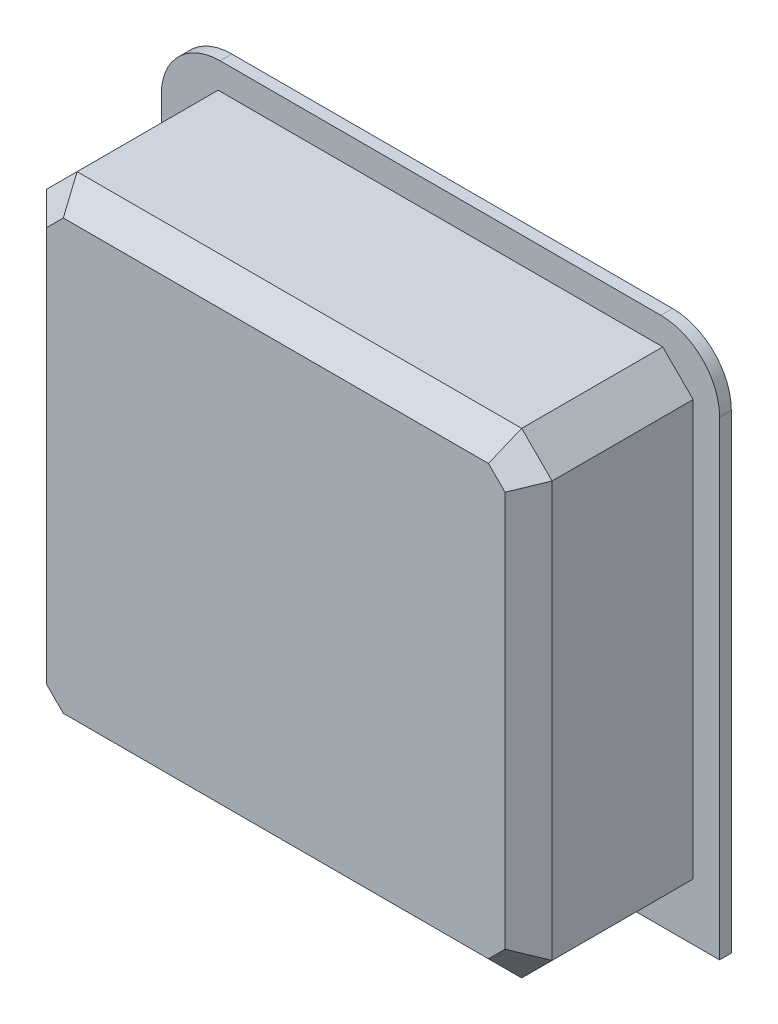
SolidWorks part; units mm, degrees
ref_plane "Front Plane" through (0, 0, 0) normal (0, 0, 1) x (1, 0, 0)
ref_plane "Top Plane" through (0, 0, 0) normal (0, 1, 0) x (1, 0, 0)
ref_plane "Right Plane" through (0, 0, 0) normal (1, 0, 0) x (0, 0, -1)
sketch "Sketch2" plane through (0, 0, 0) normal (0, 0, 1) x (1, 0, 0)
  line L0 (-37, 38.5) -> (37, 38.5)
  line L1 (47.5, -45) -> (-47.5, -45)
  line L2 (47.5, -45) -> (47.5, 45)
  line L3 (47.5, 45) -> (-47.5, 45)
  line L4 (-47.5, -45) -> (-47.5, 45)
  line L5 (47.5, -45) -> (-47.5, 45) construction
  line L6 (47.5, 45) -> (-47.5, -45) construction
  line L7 (41, 34.5) -> (41, -34.5)
  line L8 (37, -38.5) -> (-37, -38.5)
  line L9 (-41, -34.5) -> (-41, 34.5)
  line L10 (0, 38.5) -> (0, 0) construction
  line L11 (0, 0) -> (41, 0) construction
  line L12 (0, 0) -> (-41, 0) construction
  line L13 (0, 0) -> (0, -38.5) construction
  line L14 (37, 38.5) -> (41, 34.5)
  line L15 (41, -34.5) -> (37, -38.5)
  line L16 (-41, -34.5) -> (-37, -38.5)
  line L17 (-41, 34.5) -> (-37, 38.5)
  point P0 (0, 0)
  point P5 (0, 0)
  dimension "D1" = 90
  dimension "D2" = 74
  dimension "D3" = 77
  dimension "D4" = 95
  dimension "D5" = 69
  dimension "D6" = 82
extrude "Boss-Extrude1" add sketch "Sketch2" along normal blind 30
sketch "Sketch6" plane through (0, 0, 0) normal (0, 0, -1) x (-1, 0, 0)
  line L0 (-43, 35.3284) -> (-37.8284, 40.5)
  line L1 (-37, 38.5) -> (37, 38.5) construction
  line L2 (-47.5, 45) -> (47.5, 45)
  line L3 (-47.5, 45) -> (-47.5, -45)
  line L4 (-47.5, -45) -> (47.5, -45)
  line L5 (47.5, 45) -> (47.5, -45)
  line L7 (-41, 34.5) -> (-37, 38.5) construction
  line L8 (0, 0) -> (0, 50000) construction
  line L9 (0, 0) -> (-50000, 0) construction
  line L10 (-37.8284, 40.5) -> (37.8284, 40.5)
  line L11 (-43, 35.3284) -> (-43, -35.3284)
  line L12 (-41, -34.5) -> (-41, 34.5) construction
  line L13 (43, 35.3284) -> (43, -35.3284)
  line L14 (43, 35.3284) -> (37.8284, 40.5)
  line L15 (43, -35.3284) -> (37.8284, -40.5)
  line L16 (-37.8284, -40.5) -> (37.8284, -40.5)
  line L17 (-43, -35.3284) -> (-37.8284, -40.5)
  point P0 (0, 0)
  point P22 (0, 40.5)
  point P23 (43, 0)
  point P26 (-43, 0)
  dimension "D1" = 2
  dimension "D2" = 2
  dimension "D3" = 2
extrude "Cut-Extrude1" cut sketch "Sketch6" along normal blind 2 from offset 2
sketch "Sketch8" plane through (0, 0, 2) normal (0, 0, -1) x (-1, 0, 0)
  line L0 (-37.8284, 40.5) -> (-43, 35.3284)
  line L2 (-47.5, 45) -> (47.5, 45)
  line L3 (-47.5, 45) -> (-47.5, -45)
  line L4 (-47.5, -45) -> (47.5, -45)
  line L5 (47.5, 45) -> (47.5, -45)
  line L7 (-43, 35.3284) -> (-43, -35.3284)
  line L8 (-43, -35.3284) -> (-37.8284, -40.5)
  line L9 (-37.8284, -40.5) -> (37.8284, -40.5)
  line L10 (37.8284, -40.5) -> (43, -35.3284)
  line L11 (43, -35.3284) -> (43, 35.3284)
  line L12 (43, 35.3284) -> (37.8284, 40.5)
  line L13 (37.8284, 40.5) -> (-37.8284, 40.5)
  point P0 (0, 0)
extrude "Cut-Extrude2" cut sketch "Sketch8" against normal up to surface (26 mm away) from offset 2
sketch "Sketch9" plane through (0, 0, 30) normal (0, 0, 1) x (1, 0, 0)
  line L0 (-43, 35.3284) -> (-37.8284, 40.5)
  line L1 (-37.8284, 40.5) -> (37.8284, 40.5) construction
  line L2 (-43, 35.3284) -> (-37.8284, 40.5) construction
  line L3 (-37.8284, 40.5) -> (37.8284, 40.5)
  line L4 (37.8284, 40.5) -> (43, 35.3284)
  line L5 (43, 35.3284) -> (43, -35.3284)
  line L6 (43, -35.3284) -> (37.8284, -40.5)
  line L7 (43, -35.3284) -> (37.8284, -40.5) construction
  line L8 (43, -35.3284) -> (37.8284, -40.5) construction
  line L9 (37.8284, -40.5) -> (-37.8284, -40.5)
  line L10 (-37.8284, -40.5) -> (-43, -35.3284)
  line L11 (-37.8284, -40.5) -> (-43, -35.3284) construction
  line L12 (-37.8284, -40.5) -> (-43, -35.3284) construction
  line L13 (-43, -35.3284) -> (-43, 35.3284)
extrude "Boss-Extrude2" add sketch "Sketch9" along normal blind 2
chamfer "Chamfer1" distance 4 angle 45 8 edges at (40.4142, 37.9142, 32) (43, 0, 32) (40.4142, -37.9142, 32) (0, -40.5, 32) (-40.4142, -37.9142, 32) (-43, 0, 32) (-40.4142, 37.9142, 32) (0, 40.5, 32)
fillet "Fillet2" radius 10 2 edges at (47.5, 45, 3) (-47.5, 45, 3)
